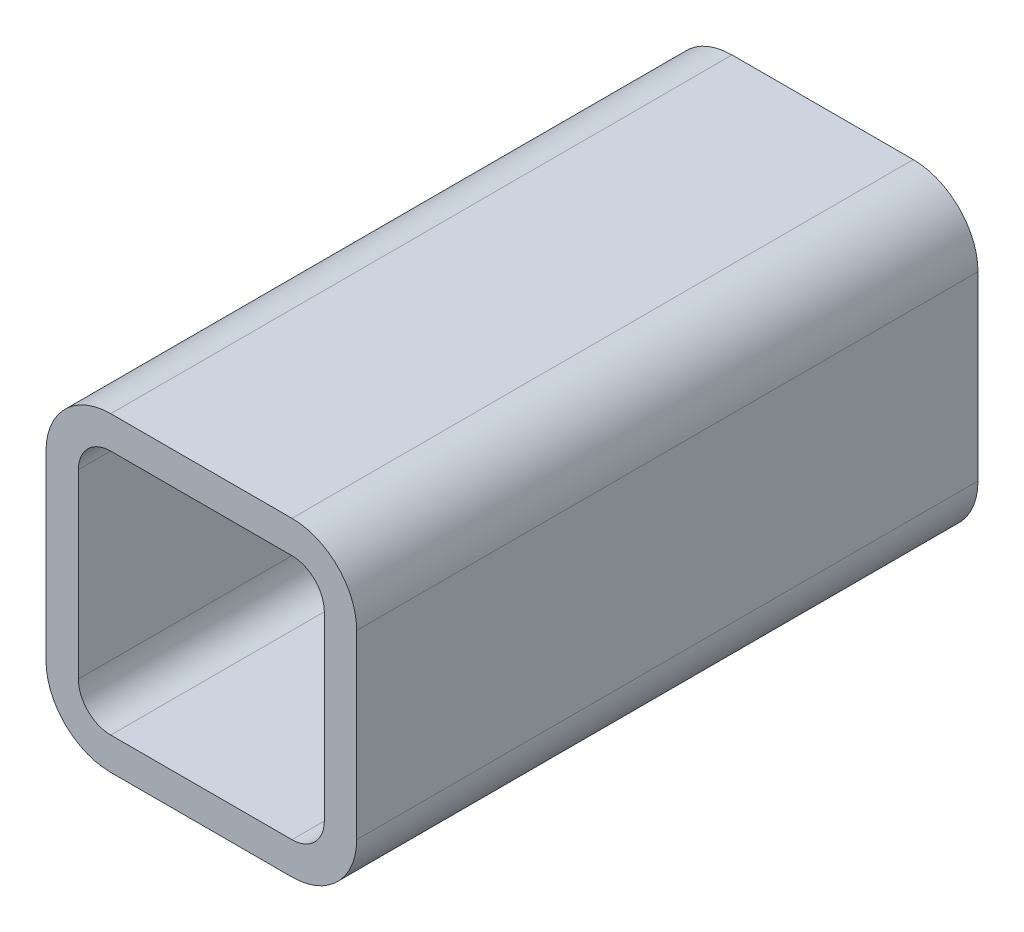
SolidWorks part; units mm, degrees
ref_plane "Front Plane" through (0, 0, 0) normal (0, 0, 1) x (1, 0, 0)
ref_plane "Top Plane" through (0, 0, 0) normal (0, 1, 0) x (1, 0, 0)
ref_plane "Right Plane" through (0, 0, 0) normal (1, 0, 0) x (0, 0, -1)
sketch "Sketch1" plane through (0, 0, 0) normal (0, 0, 1) x (1, 0, 0)
sketch_block_instance "HSS6x6x0.625-1"
sketch_block "HSS6x6x0.625"
extrude "Boss-Extrude1" add sketch "Sketch1" along normal blind 304.8
